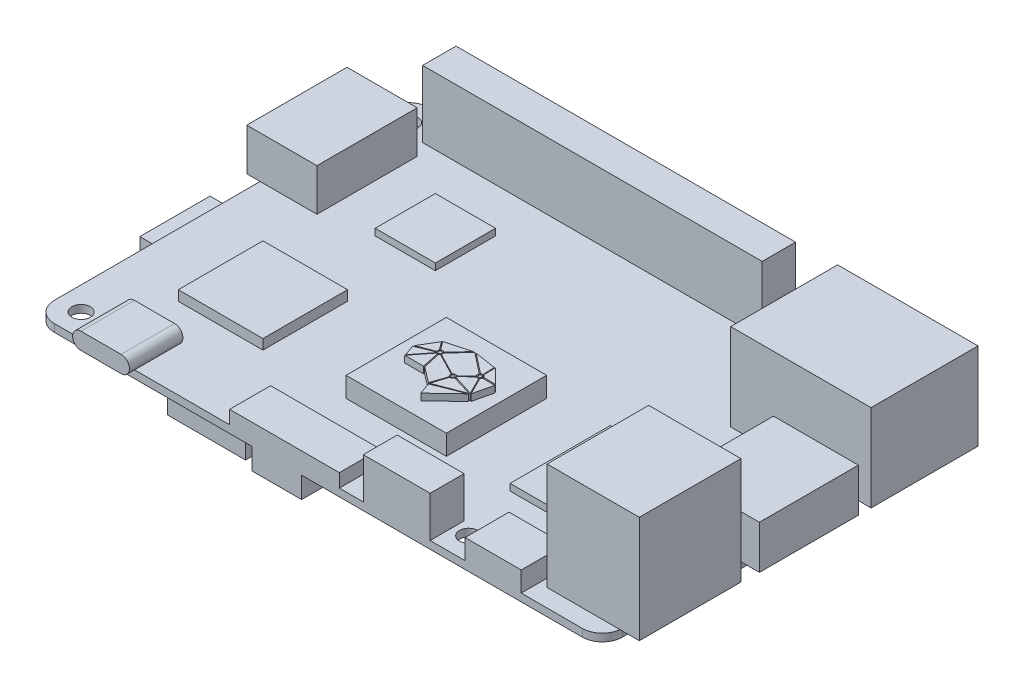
SolidWorks part; units mm, degrees
other "相机1"
other "相机2"
ref_plane "前视基准面" through (0, 0, 0) normal (0, 0, 1) x (1, 0, 0)
ref_plane "上视基准面" through (0, 0, 0) normal (0, 1, 0) x (1, 0, 0)
ref_plane "右视基准面" through (0, 0, 0) normal (1, 0, 0) x (0, 0, -1)
sketch "草图1" plane through (0, 0, 0) normal (0, 1, 0) x (1, 0, 0)
  line L1 (-42.5, -28) -> (42.5, -28)
  line L2 (-42.5, -28) -> (-42.5, 28)
  line L3 (-42.5, 28) -> (42.5, 28)
  line L4 (42.5, -28) -> (42.5, 28)
  line L5 (-42.5, -28) -> (42.5, 28) construction
  line L6 (-42.5, 28) -> (42.5, -28) construction
  point P0 (0, 0)
  dimension "D1" = 85
  dimension "D2" = 56
extrude "凸台-拉伸1" add sketch "草图1" along normal blind 1.14
fillet "圆角1" radius 3 4 edges at (-42.5, 0.57, -28) (-42.5, 0.57, 28) (42.5, 0.57, -28) (42.5, 0.57, 28)
sketch "草图2" plane through (0, 1.14, 0) normal (0, 1, 0) x (1, 0, 0)
  line L0 (-39.5, -28) -> (39.5, -28) construction
  line L1 (31.57, -10.14) -> (45.37, -10.14)
  line L2 (31.57, -10.14) -> (31.57, -25.34)
  line L3 (31.57, -25.34) -> (45.37, -25.34)
  line L4 (45.37, -10.14) -> (45.37, -25.34)
  line L5 (31.57, -10.14) -> (45.37, -25.34) construction
  line L6 (31.57, -25.34) -> (45.37, -10.14) construction
  line L7 (42.5, -25) -> (42.5, 25) construction
  point P0 (38.47, -17.74)
  dimension "D1" = 13.8
  dimension "D2" = 15.2
  dimension "D3" = 2.66
  dimension "D4" = 2.87
extrude "凸台-拉伸2" add sketch "草图2" along normal blind 16
sketch "草图3" plane through (0, 1.14, 0) normal (0, 1, 0) x (1, 0, 0)
  line L0 (-39.5, -28) -> (39.5, -28) construction
  line L1 (32.8041, 7.3) -> (45.5, 7.3)
  line L2 (32.8041, 7.3) -> (32.8041, -7.5)
  line L3 (32.8041, -7.5) -> (45.5, -7.5)
  line L4 (45.5, 7.3) -> (45.5, -7.5)
  line L5 (42.5, -10.14) -> (42.5, 25) construction
  dimension "D1" = 20.5
  dimension "D2" = 14.8
  dimension "D3" = 3
extrude "凸台-拉伸3" add sketch "草图3" along normal blind 6.5
sketch "草图5" plane through (0, 1.14, 0) normal (0, 1, 0) x (1, 0, 0)
  line L0 (39.5, 28) -> (-39.5, 28) construction
  line L1 (24.5, 25.2) -> (45.5, 25.2)
  line L2 (24.5, 25.2) -> (24.5, 9.2)
  line L3 (24.5, 9.2) -> (45.5, 9.2)
  line L4 (45.5, 25.2) -> (45.5, 9.2)
  line L5 (42.5, 7.3) -> (42.5, 25) construction
  dimension "D1" = 2.8
  dimension "D2" = 16
  dimension "D3" = 21
  dimension "D4" = 3
extrude "凸台-拉伸4" add sketch "草图5" along normal blind 13
sketch "草图6" plane through (0, 1.14, 0) normal (0, 1, 0) x (1, 0, 0)
  line L0 (-39, 24.5) -> (-38.9871, -24.5) construction
  line L1 (39.5, 28) -> (-39.5, 28) construction
  line L2 (-42.5, 25) -> (-42.5, -25) construction
  line L3 (19, 24.5) -> (19, -24.5004) construction
  circle A0 centre (-39, 24.5) radius 1.38
  circle A1 centre (19, 24.5) radius 1.38
  circle A2 centre (-38.9871, -24.5) radius 1.38
  circle A3 centre (19, -24.5) radius 1.38
  dimension "D1" = 2.76
  dimension "D2" = 49
  dimension "D3" = 3.5
  dimension "D4" = 3.5
  dimension "D5" = 58
  dimension "D6" = 49
  dimension "D7" = 3.5
extrude "切除-拉伸1" cut sketch "草图6" against normal through all
sketch "草图7" plane through (0, 1.14, 0) normal (0, 1, 0) x (1, 0, 0)
  line L0 (-42.5, 25) -> (-42.5, -25) construction
  line L1 (-35.39, 28) -> (15.41, 28)
  line L2 (-35.39, 28) -> (-35.39, 23)
  line L3 (-35.39, 23) -> (15.41, 23)
  line L4 (15.41, 28) -> (15.41, 23)
  line L5 (39.5, 28) -> (-39.5, 28) construction
  dimension "D1" = 7.11
  dimension "D2" = 50.8
  dimension "D3" = 5
  dimension "D4" = 0
extrude "凸台-拉伸5" add sketch "草图7" along normal blind 10
sketch "草图8" plane through (0, 1.14, 0) normal (0, 1, 0) x (1, 0, 0)
  line L0 (-35.39, 28) -> (-39.5, 28) construction
  line L1 (-34, 20.8) -> (-44.5, 20.8)
  line L2 (-34, 20.8) -> (-34, 5.8)
  line L3 (-34, 5.8) -> (-44.5, 5.8)
  line L4 (-44.5, 20.8) -> (-44.5, 5.8)
  line L5 (-42.5, 25) -> (-42.5, -25) construction
  dimension "D1" = 7.2
  dimension "D2" = 2
  dimension "D3" = 15
  dimension "D4" = 10.5
extrude "凸台-拉伸6" add sketch "草图8" along normal blind 6.3
sketch "草图9" plane through (0, 0, 0) normal (0, -1, 0) x (1, 0, 0)
  line L0 (-39.5, 28) -> (39.5, 28) construction
  line L1 (-42.5, -4.3) -> (-28, -4.3)
  line L2 (-42.5, -4.3) -> (-42.5, 10.2)
  line L3 (-42.5, 10.2) -> (-28, 10.2)
  line L4 (-28, -4.3) -> (-28, 10.2)
  line L5 (-42.5, -25) -> (-42.5, 25) construction
  dimension "D1" = 17.8
  dimension "D2" = 14.5
  dimension "D3" = 14.5
  dimension "D4" = 0
extrude "凸台-拉伸7" add sketch "草图9" along normal blind 2
sketch "草图10" plane through (0, -2, 0) normal (0, -1, 0) x (1, 0, 0)
  line L0 (-28, 10.2) -> (-42.5, 10.2) construction
  line L1 (-45.5, 9.2) -> (-36.6948, 9.2)
  line L2 (-45.5, 9.2) -> (-45.5, -1.3)
  line L3 (-45.5, -1.3) -> (-36.6948, -1.3)
  line L4 (-36.6948, 9.2) -> (-36.6948, -1.3)
  line L5 (-42.5, 10.2) -> (-42.5, -4.3) construction
  dimension "D1" = 1
  dimension "D2" = 3
  dimension "D3" = 10.5
extrude "凸台-拉伸8" add sketch "草图10" against normal up to surface (2 mm away)
ref_plane "基准面1" through (0, 0, 29.5) normal (0, 0, 1) x (1, 0, 0)
sketch "草图11" plane through (0, 1.14, 0) normal (0, 1, 0) x (1, 0, 0)
  line L1 (-42.5, -5.7224) -> (-42.5, -40.0085) construction
sketch "草图12" plane through (0, 0, 29.5) normal (0, 0, 1) x (1, 0, 0)
  line L0 (-34, 2.39) -> (-28, 2.39) construction
  line L5 (-34, 3.64) -> (-28, 3.64)
  line L6 (-34, 1.14) -> (-28, 1.14)
  line L8 (-35.39, 1.14) -> (15.41, 1.14) construction
  arc A2 (-34, 3.64) -> (-34, 1.14) centre (-34, 2.39) ccw
  arc A3 (-28, 1.14) -> (-28, 3.64) centre (-28, 2.39) ccw
  point P2 (-31, 2.39)
  dimension "D1" = 6
  dimension "D2" = 2.5
  dimension "D3" = 0
  dimension "D4" = 8.5
extrude "凸台-拉伸9" add sketch "草图12" against normal blind 8
sketch "草图13" plane through (0, 1.14, 0) normal (0, 1, 0) x (1, 0, 0)
  line L0 (-42.5, 199994.2776) -> (-42.5, -200040.0085) construction
  line L1 (-13.26, -21.88) -> (3.15, -21.88)
  line L2 (-13.26, -21.88) -> (-13.26, -28)
  line L3 (-13.26, -28) -> (3.15, -28)
  line L4 (3.15, -21.88) -> (3.15, -28)
  line L5 (-28, -28) -> (39.5, -28) construction
  dimension "D1" = 29.24
  dimension "D2" = 16.41
  dimension "D3" = 6.12
  dimension "D4" = 0
extrude "凸台-拉伸10" add sketch "草图13" along normal blind 2
sketch "草图14" plane through (0, 1.14, 0) normal (0, 1, 0) x (1, 0, 0)
  line L0 (-42.5, 199994.2776) -> (-42.5, -200040.0085) construction
  line L1 (6.73, -22.92) -> (16.73, -22.92)
  line L2 (6.73, -22.92) -> (6.73, -28)
  line L3 (6.73, -28) -> (16.73, -28)
  line L4 (16.73, -22.92) -> (16.73, -28)
  line L5 (3.15, -28) -> (39.5, -28) construction
  dimension "D1" = 49.23
  dimension "D2" = 10
  dimension "D3" = 5.08
  dimension "D4" = 0
extrude "凸台-拉伸11" add sketch "草图14" along normal blind 6.12
sketch "草图15" plane through (0, 0, 0) normal (0, -1, 0) x (1, 0, 0)
  line L0 (-42.5, -199994.2776) -> (-42.5, 200040.0085) construction
  line L1 (-23.15, 27.43) -> (-11.45, 27.43)
  line L2 (-23.15, 27.43) -> (-23.15, 22.43)
  line L3 (-23.15, 22.43) -> (-11.45, 22.43)
  line L4 (-11.45, 27.43) -> (-11.45, 22.43)
  line L5 (-39.5, 28) -> (39.5, 28) construction
  dimension "D1" = 19.35
  dimension "D2" = 11.7
  dimension "D3" = 5
  dimension "D4" = 0.57
extrude "凸台-拉伸12" add sketch "草图15" along normal blind 2.81
sketch "草图16" plane through (0, 0, 0) normal (0, -1, 0) x (1, 0, 0)
  line L0 (-42.5, -199994.2776) -> (-42.5, 200040.0085) construction
  line L1 (-9.92, 28) -> (-2.5, 28)
  line L2 (-9.92, 28) -> (-9.92, 22.85)
  line L3 (-9.92, 22.85) -> (-2.5, 22.85)
  line L4 (-2.5, 28) -> (-2.5, 22.85)
  line L5 (-39.5, 28) -> (39.5, 28) construction
  dimension "D1" = 32.58
  dimension "D2" = 7.42
  dimension "D3" = 5.15
  dimension "D4" = 0
extrude "凸台-拉伸13" add sketch "草图16" along normal blind 3.18
sketch "草图17" plane through (0, 1.14, 0) normal (0, 1, 0) x (1, 0, 0)
  line L0 (-42.5, 199994.2776) -> (-42.5, -200040.0085) construction
  line L1 (21.96, -21.42) -> (30.36, -21.42)
  line L2 (21.96, -21.42) -> (21.96, -28)
  line L3 (21.96, -28) -> (30.36, -28)
  line L4 (30.36, -21.42) -> (30.36, -28)
  line L5 (16.73, -28) -> (39.5, -28) construction
  dimension "D1" = 64.46
  dimension "D2" = 8.4
  dimension "D3" = 6.58
  dimension "D4" = 0
extrude "凸台-拉伸14" add sketch "草图17" along normal blind 3
sketch "草图19" plane through (0, 1.14, 0) normal (0, 1, 0) x (1, 0, 0)
  line L0 (-42.5, 5.8) -> (-42.5, -25) construction
  line L1 (-33.1, -3.18) -> (-20.44, -3.18)
  line L2 (-33.1, -3.18) -> (-33.1, -15.84)
  line L3 (-33.1, -15.84) -> (-20.44, -15.84)
  line L4 (-20.44, -3.18) -> (-20.44, -15.84)
  line L5 (-28, -28) -> (-13.26, -28) construction
  dimension "D1" = 9.4
  dimension "D2" = 12.16
  dimension "D3" = 12.66
  dimension "D4" = 12.66
extrude "凸台-拉伸15" add sketch "草图19" along normal blind 1.5
sketch "草图20" plane through (0, 1.14, 0) normal (0, 1, 0) x (1, 0, 0)
  line L0 (-42.5, 5.8) -> (-42.5, -25) construction
  line L1 (-7.96, -0.88) -> (7.04, -0.88)
  line L2 (-7.96, -0.88) -> (-7.96, -15.88)
  line L3 (-7.96, -15.88) -> (7.04, -15.88)
  line L4 (7.04, -0.88) -> (7.04, -15.88)
  line L5 (3.15, -28) -> (6.73, -28) construction
  dimension "D1" = 34.54
  dimension "D2" = 12.12
  dimension "D3" = 15
  dimension "D4" = 15
extrude "凸台-拉伸16" add sketch "草图20" along normal blind 3
sketch "草图22" plane through (0, 1.14, 0) normal (0, 1, 0) x (1, 0, 0)
  line L0 (-42.5, 5.8) -> (-42.5, -25) construction
  line L1 (16.31, -0.61) -> (26.31, -0.61)
  line L2 (16.31, -0.61) -> (16.31, -15.61)
  line L3 (16.31, -15.61) -> (26.31, -15.61)
  line L4 (26.31, -0.61) -> (26.31, -15.61)
  line L5 (16.73, -28) -> (21.96, -28) construction
  dimension "D1" = 58.81
  dimension "D2" = 12.39
  dimension "D3" = 15
  dimension "D4" = 10
extrude "凸台-拉伸17" add sketch "草图22" along normal blind 1
sketch "草图23" plane through (0, 1.14, 0) normal (0, 1, 0) x (1, 0, 0)
  line L0 (-42.5, 5.8) -> (-42.5, -25) construction
  line L1 (-26.83, 16.35) -> (-17.83, 16.35)
  line L2 (-26.83, 16.35) -> (-26.83, 7.35)
  line L3 (-26.83, 7.35) -> (-17.83, 7.35)
  line L4 (-17.83, 16.35) -> (-17.83, 7.35)
  line L5 (-28, -28) -> (-13.26, -28) construction
  dimension "D1" = 15.67
  dimension "D2" = 35.35
  dimension "D3" = 9
  dimension "D4" = 9
extrude "凸台-拉伸18" add sketch "草图23" along normal blind 1
sketch "草图27" plane through (0, 4.14, 0) normal (0, 1, 0) x (1, 0, 0)
  line L0 (48.0142, 116.8123) -> (272.0142, 116.8123) construction
  line L1 (-3.2468, -6.6354) -> (-4.1852, -5.3743)
  line L2 (-4.1852, -5.3743) -> (-5.6693, -7.9008)
  line L3 (-5.6693, -7.9008) -> (-3.2934, -7.0174)
  line L4 (-3.2468, -7.1076) -> (-5.7594, -8.1226)
  line L5 (-5.7594, -8.1226) -> (-5.1711, -9.7646)
  line L6 (-5.1711, -9.7646) -> (-3.1595, -7.2008)
  line L7 (-3.0795, -7.2501) -> (-5.1639, -9.8992)
  line L8 (-5.1639, -9.8992) -> (-2.347, -9.8992)
  line L9 (-2.347, -9.8992) -> (-2.9011, -7.2901)
  line L10 (-2.7493, -7.2616) -> (-2.1748, -9.8992)
  line L11 (-2.1748, -9.8992) -> (0.1605, -11.667)
  line L12 (0.1605, -11.667) -> (0.9454, -9.3347)
  line L13 (0.7626, -8.8644) -> (-2.5789, -7.1387)
  line L14 (-2.5253, -7.0559) -> (0.8057, -8.7744)
  line L15 (1.0523, -9.3755) -> (0.3189, -11.667)
  line L16 (0.3189, -11.667) -> (4.596, -10.0331)
  line L17 (4.596, -10.0331) -> (1.5178, -9.1035)
  line L18 (4.596, -10.1262) -> (0.3189, -11.8428)
  line L19 (0.3189, -11.8428) -> (0.9454, -13.5937)
  line L20 (0.9454, -13.5937) -> (4.596, -10.1262)
  line L21 (1.5296, -8.9252) -> (4.645, -9.8992)
  line L22 (4.645, -9.8992) -> (3.3765, -7.3438)
  line L23 (2.9981, -7.3438) -> (1.4716, -8.7744)
  line L24 (1.3683, -8.6662) -> (2.8844, -7.2616)
  line L25 (3.4592, -7.2901) -> (4.7814, -9.8992)
  line L26 (4.7814, -9.8992) -> (5.4666, -7.0559)
  line L27 (5.4666, -7.0559) -> (3.6025, -7.0559)
  line L28 (3.6025, -6.8694) -> (5.3501, -6.8694)
  line L29 (5.3501, -6.8694) -> (3.2614, -4.7807)
  line L30 (3.2614, -4.7807) -> (3.2614, -6.5436)
  line L31 (3.1873, -6.5371) -> (3.1204, -4.7807)
  line L32 (3.1204, -4.7807) -> (-0.1003, -4.2874)
  line L33 (-0.1003, -4.2874) -> (2.9154, -6.6354)
  line L34 (2.8261, -6.7377) -> (-0.286, -4.2874)
  line L35 (-0.286, -4.2874) -> (-2.5295, -6.6787)
  line L36 (-2.6408, -6.5436) -> (-0.5024, -4.2874)
  line L37 (-0.5024, -4.2874) -> (-4.1034, -5.2786)
  line L38 (-4.1034, -5.2786) -> (-3.1533, -6.5373)
  circle A0 centre (-2.9011, -6.8715) radius 0.2414
  circle A1 centre (-2.9011, -6.8715) radius 0.4186
  circle A2 centre (3.1873, -6.9627) radius 0.2239
  circle A3 centre (3.1873, -6.9627) radius 0.4256
  circle A4 centre (1.1386, -8.9889) radius 0.2239
  circle A5 centre (1.1386, -8.9889) radius 0.3961
  point P59 (0, 0)
  point P65 (0, 0)
sketch "草图28" plane through (0, 1.14, 0) normal (0, 1, 0) x (1, 0, 0)
extrude "凸台-拉伸19" add sketch "草图27" along normal blind 1 contours A1 L7 L8 L9 | A1 L4 L5 L6 | A1 L1 L2 L3 | A5 L24 A3 L34 L35 A1 L14 | A5 L13 A1 L10 L11 L12 | A5 L15 L16 L17 | A5 L21 L22 A3 L23 | A3 L25 L26 L27 | A2 | A3 L31 L32 L33 | A3 L28 L29 L30 | A1 L36 L37 L38 | L19 L20 L18 | A0 | A4
